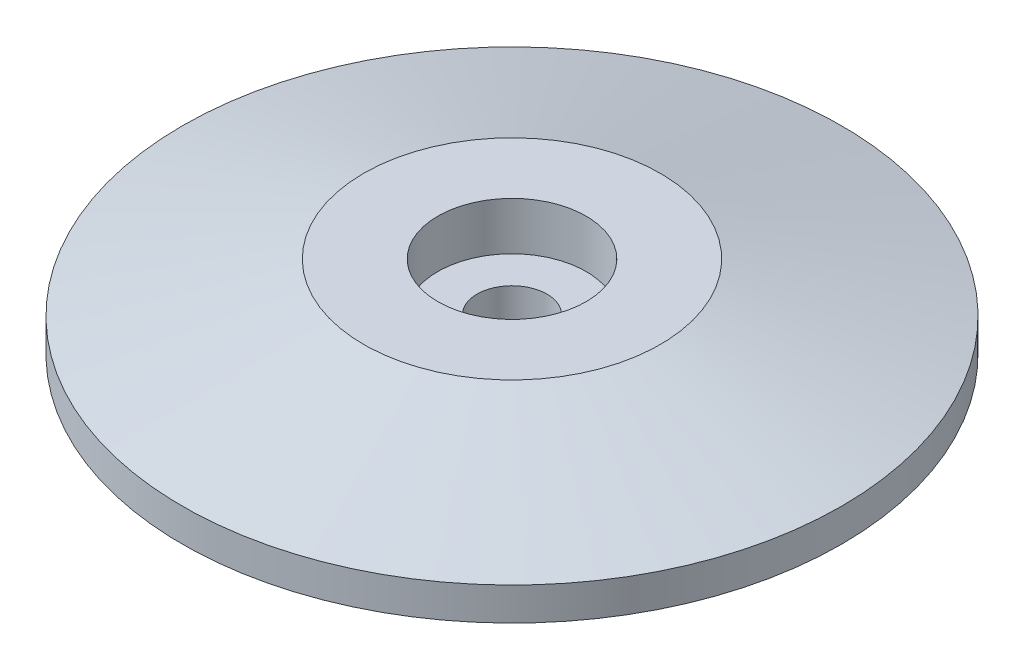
SolidWorks part; units mm, degrees
ref_plane "Front" through (0, 0, 0) normal (0, 0, 1) x (1, 0, 0)
ref_plane "Top" through (0, 0, 0) normal (0, 1, 0) x (1, 0, 0)
ref_plane "Right" through (0, 0, 0) normal (1, 0, 0) x (0, 0, -1)
sketch "Sketch1" plane through (0, 0, 0) normal (0, 0, 1) x (1, 0, 0)
  line L0 (0, 0) -> (63.5, 0)
  line L1 (63.5, 0) -> (63.5, 6.35)
  line L2 (63.5, 6.35) -> (28.575, 15.875)
  line L3 (28.575, 15.875) -> (0, 15.875)
  line L4 (0, 15.875) -> (0, 0) construction
  line L5 (0, 0) -> (0, 15.875)
  dimension "MainOD" = 127
  dimension "D2" = 57.15
  dimension "D3" = 15.875
  dimension "D4" = 6.35
revolve "Base-Revolve" add sketch "Sketch1" angle 360 about L4
sketch "Sketch2" plane through (0, 0, 0) normal (0, 0, 1) x (1, 0, 0)
  line L0 (-63.5, 0) -> (63.5, 0) construction
  line L1 (26.9875, 0) -> (31.75, 0)
  line L2 (26.9875, 0) -> (26.9875, 3.175)
  line L3 (26.9875, 3.175) -> (31.75, 3.175)
  line L4 (31.75, 0) -> (31.75, 3.175)
  line L5 (0, 0) -> (0, 32.6765) construction
  dimension "Groove_OD" = 63.5
  dimension "Groove_ID" = 53.975
  dimension "Groove_Depth" = 3.175
revolve "Groove" cut sketch "Sketch2" angle 360 about L5
hole_wizard "CBORE for 1/2 Hex Head Bolt1" positions "Sketch4" profile "Sketch3" counterbore size "1/2" standard "Ansi Inch"
sketch "Sketch4" plane through (0, 15.875, 0) normal (0, 1, 0) x (-1, 0, 0)
  circle A0 centre (0, 0) radius 28.575 construction
  point P0 (0, 0)
sketch "Sketch3" plane through (0, 15.875, 0) normal (1, 0, 0) x (0, 0, 1)
  line L0 (0, 0) -> (0, 15.875)
  line L1 (0, 15.875) -> (6.7462, 15.875)
  line L3 (6.7462, 15.875) -> (6.7462, 9.2456)
  line L4 (6.7462, 9.2456) -> (14.2875, 9.2456)
  line L5 (14.2875, 9.2456) -> (14.2875, 0)
  line L7 (14.2875, 0) -> (0, 0)
  line L11 (0, -6.35) -> (0, 107.95) construction
  dimension "Thru Hole Dia." = 13.4925
  dimension "Thru Hole Depth" = 15.875
  dimension "C'Bore Dia." = 28.575
  dimension "C'Bore Depth" = 9.2456
